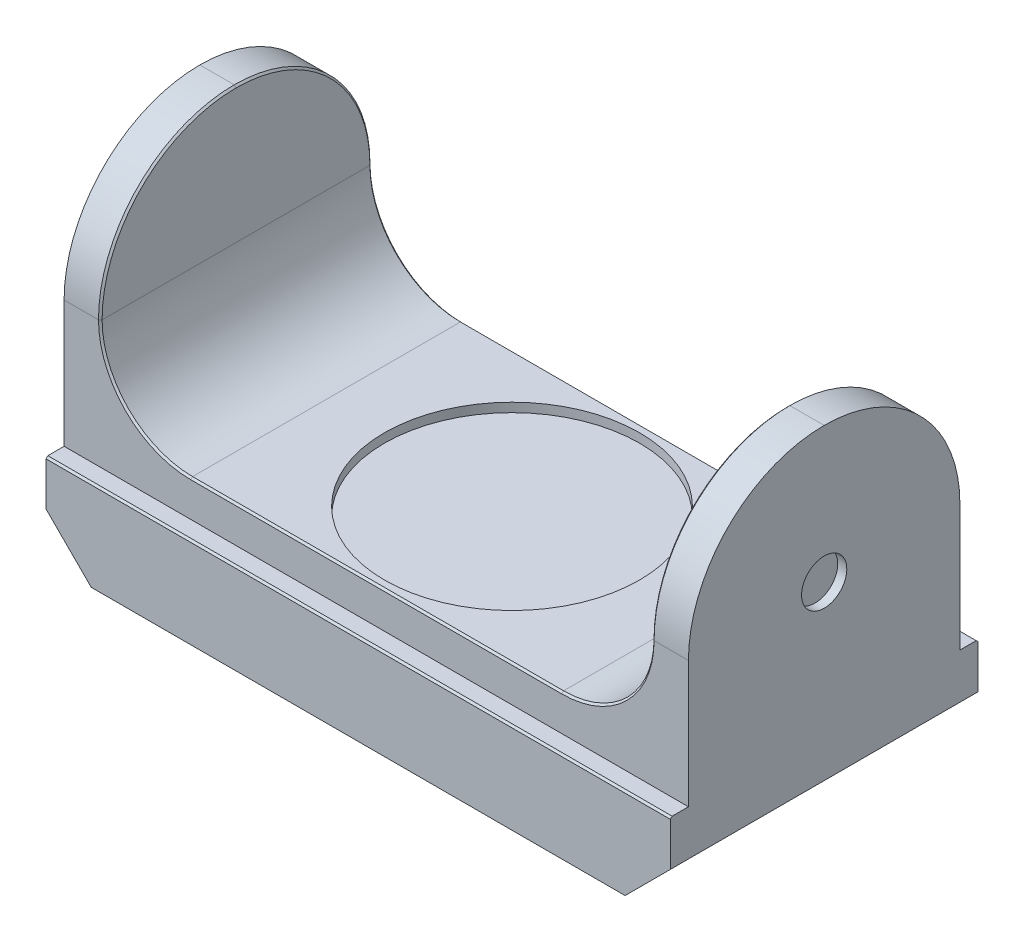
SolidWorks part; units mm, degrees
ref_plane "Face" through (0, 0, 0) normal (0, 0, 1) x (1, 0, 0)
ref_plane "Dessus" through (0, 0, 0) normal (0, 1, 0) x (1, 0, 0)
ref_plane "Droite" through (0, 0, 0) normal (1, 0, 0) x (0, 0, -1)
sketch "Esquisse1" plane through (0, 0, 0) normal (0, 0, 1) x (1, 0, 0)
  line L0 (-345, 0) -> (345, 0)
  line L1 (345, 0) -> (345, 290)
  line L2 (345, 290) -> (305, 290)
  line L3 (305, 290) -> (305, 140)
  line L4 (205, 40) -> (-205, 40)
  line L5 (-305, 140) -> (-305, 290)
  line L6 (-305, 290) -> (-345, 290)
  line L7 (-345, 290) -> (-345, 0)
  arc A0 (-205, 40) -> (-305, 140) centre (-205, 140) cw
  arc A1 (305, 140) -> (205, 40) centre (205, 140) cw
  point P11 (-305, 40)
  point P14 (305, 40)
  dimension "D5" = 100
  dimension "D1" = 610
  dimension "D2" = 40
  dimension "D3" = 250
  dimension "D4" = 40
extrude "Extrusion1" add sketch "Esquisse1" along normal mid plane 300
fillet "Congé1" radius 150 12 edges at (305, 215, -150) (325, 290, -150) (325, 290, 150) (-345, 290, 0) (-305, 290, 0) (305, 215, 150) (305, 290, 0) (345, 290, 0) (-305, 215, 150) (-325, 290, 150) (-325, 290, -150) (-305, 215, -150)
sketch "Esquisse2" plane through (0, 0, 0) normal (0, 0, 1) x (1, 0, 0)
  line L0 (-345, 0) -> (345, 0)
  line L1 (345, 0) -> (345, -100)
  line L2 (345, -100) -> (-345, -100)
  line L3 (-345, -100) -> (-345, 0)
  line L4 (345, 0) -> (345, 140) construction
  line L5 (-345, 140) -> (-345, 0) construction
  dimension "D1" = 100
extrude "Extrusion2" add sketch "Esquisse2" along normal mid plane 340
chamfer "Chanfrein1" distance 50 angle 45 2 edges at (-345, -100, 0) (345, -100, 0)
sketch "Esquisse3" plane through (345, 0, 0) normal (1, 0, 0) x (0, 0, -1)
  circle A0 centre (0, 140) radius 25
  arc A1 (0, 290) -> (-150, 140) centre (0, 140) ccw construction
  dimension "D1" = 50
extrude "Enlèv. mat.-Extru.1" cut sketch "Esquisse3" against normal blind 10
sketch "Esquisse4" plane through (0, 40, 0) normal (0, 1, 0) x (-1, 0, 0)
  circle A0 centre (0, 0) radius 141
  dimension "D1" = 282
extrude "Enlèv. mat.-Extru.2" cut sketch "Esquisse4" against normal blind 10
chamfer "Chanfrein2" distance 2 angle 45 14 edges at (275.7107, 69.2893, 150) (0, 40, 150) (-275.7107, 69.2893, 150) (305, 246.066, 106.066) (305, 246.066, -106.066) (-305, 246.066, 106.066) (-305, 246.066, -106.066) (0, 0, -170) (0, 0, 170) (-275.7107, 69.2893, -150) (0, 40, -150) (275.7107, 69.2893, -150)
